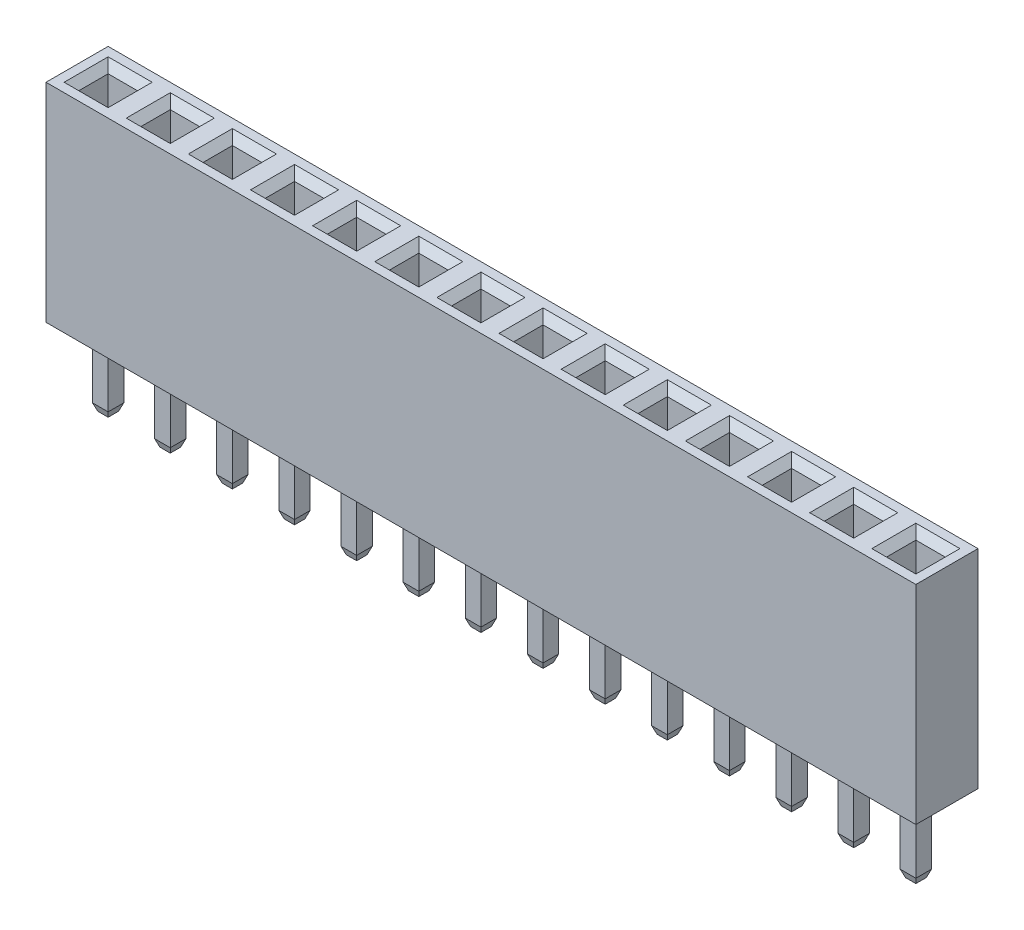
SolidWorks part; units mm, degrees
ref_plane "Front" through (0, 0, 0) normal (0, 0, 1) x (1, 0, 0)
ref_plane "Top" through (0, 0, 0) normal (0, 1, 0) x (1, 0, 0)
ref_plane "Right" through (0, 0, 0) normal (1, 0, 0) x (0, 0, -1)
sketch "Эскиз2" plane through (0, 0, 0) normal (0, 1, 0) x (1, 0, 0)
  line L1 (-1.27, 1.27) -> (1.27, 1.27)
  line L2 (-1.27, 1.27) -> (-1.27, -1.27)
  line L3 (-1.27, -1.27) -> (1.27, -1.27)
  line L4 (1.27, 1.27) -> (1.27, -1.27)
  line L8 (0, -1.27) -> (0, 1.27) construction
  dimension "D1" = 2.54
  dimension "D2" = 2.54
  dimension "D4" = 1.27
extrude "Вытянуть2" add sketch "Эскиз2" along normal blind 8.5
sketch "Эскиз3" plane through (0, 8.5, 0) normal (0, 1, 0) x (-1, 0, 0)
  line L0 (0, 0.6) -> (0, -0.6) construction
  line L1 (0.6, 0.6) -> (-0.6, 0.6)
  line L2 (0.6, 0.6) -> (0.6, -0.6)
  line L3 (0.6, -0.6) -> (-0.6, -0.6)
  line L4 (-0.6, 0.6) -> (-0.6, -0.6)
  dimension "D1" = 1.2
extrude "Вырез-Вытянуть1" cut sketch "Эскиз3" against normal blind 6.2
chamfer "Фаска3" distance 0.3 angle 45 4 edges at (-0.6, 8.5, 0) (0, 8.5, 0.6) (0.6, 8.5, 0) (0, 8.5, -0.6)
sketch "Эскиз1" plane through (0, 0, 0) normal (0, 1, 0) x (1, 0, 0)
  line L0 (-0.32, 0) -> (0.32, 0) construction
  line L1 (-0.32, 0.32) -> (0.32, 0.32)
  line L2 (-0.32, 0.32) -> (-0.32, -0.32)
  line L3 (-0.32, -0.32) -> (0.32, -0.32)
  line L4 (0.32, 0.32) -> (0.32, -0.32)
  dimension "D1" = 0.64
extrude "Вытянуть1" add sketch "Эскиз1" against normal blind 3.15
chamfer "Фаска1" distance 0.3 angle 20 4 edges at (0, -3.15, -0.32) (0.32, -3.15, 0) (0, -3.15, 0.32) (-0.32, -3.15, 0)
pattern_linear "Линейный массив1" count 14 spacing 2.54 along (-1, 0, 0) of "Вытянуть2", "Вырез-Вытянуть1", "Фаска3"
pattern_linear "Линейный массив2" count 60 spacing 2.54 along (-1, 0, 0) of "Вытянуть1", "Фаска1"
